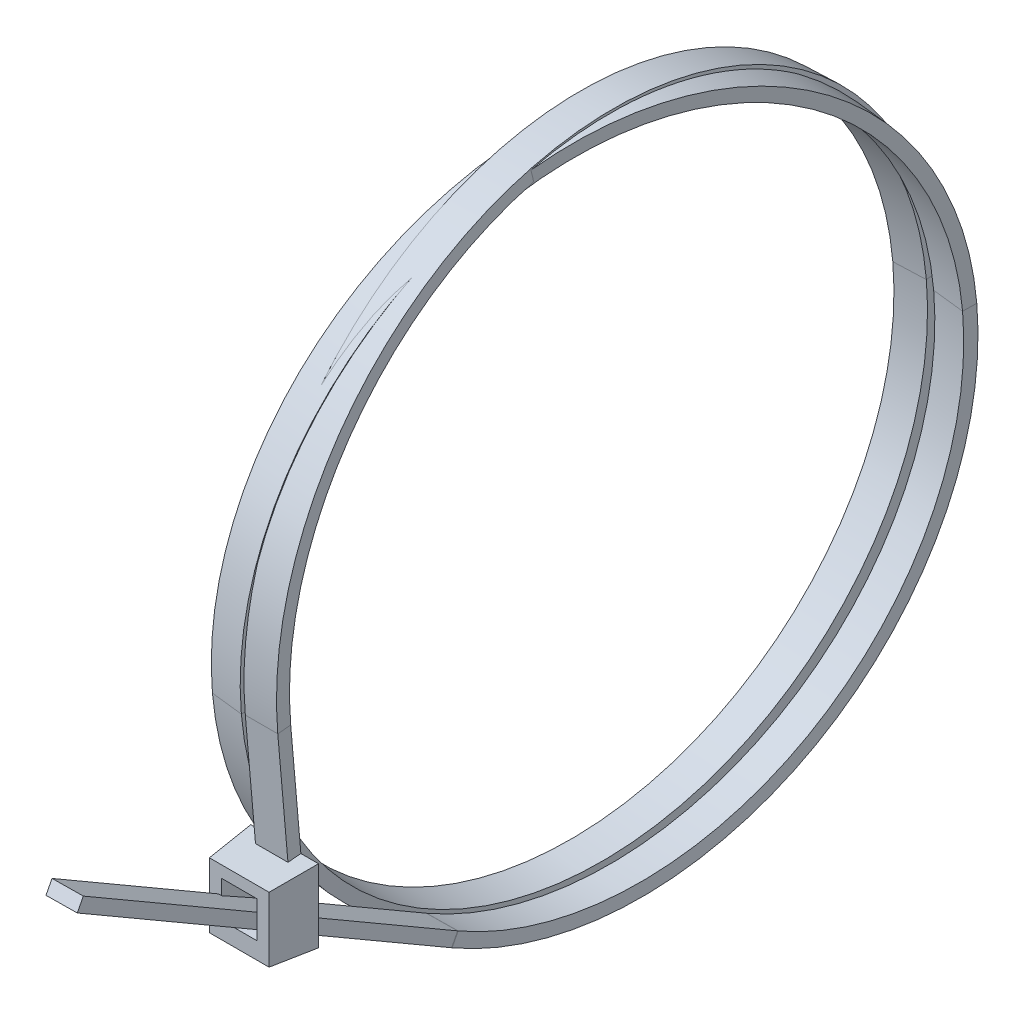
SolidWorks part; units mm, degrees
ref_plane "Plane1" through (0, 0, 0) normal (0, 0, 1) x (1, 0, 0)
ref_plane "Plane2" through (0, 0, 0) normal (0, 1, 0) x (1, 0, 0)
ref_plane "Plane3" through (0, 0, 0) normal (1, 0, 0) x (0, 0, -1)
sketch "Sketch1" plane through (0, 0, 0) normal (0, 0, 1) x (1, 0, 0)
  line L0 (-2.3, 2.5) -> (2.3, 2.5)
  line L1 (-2.3, 2.5) -> (-2.3, -2.5)
  line L2 (2.3, -2.5) -> (-2.3, -2.5)
  line L3 (2.3, -2.5) -> (2.3, 2.5)
  dimension "D1" = 2.3
  dimension "D2" = 4.6
  dimension "D3" = 5
  dimension "D4" = 2.5
extrude "Base-Extrude" add sketch "Sketch1" against normal blind 3.5 draft 5
sketch "Sketch2" plane through (0, 0, 0) normal (0, 0, 1) x (1, 0, 0)
  line L0 (-1.35, 1.6) -> (1.35, 1.6)
  line L1 (-1.35, 1.6) -> (-1.35, -1.2)
  line L2 (1.35, -1.2) -> (-1.35, -1.2)
  line L3 (1.35, -1.2) -> (1.35, 1.6)
  line L5 (2.3, -2.5) -> (-2.3, -2.5) construction
  dimension "D1" = 2.7
  dimension "D2" = 1.35
  dimension "D3" = 2.8
  dimension "D4" = 1.3
extrude "Cut-Extrude1" cut sketch "Sketch2" against normal through all
sketch "Sketch3" plane through (0, 0, 0) normal (1, 0, 0) x (0, 0, -1)
  line L0 (2.4, 2.71) -> (2.4, 6.21) construction
  line L1 (3.5, 2.8062) -> (0, 2.5) construction
  line L3 (3.5, -2.8062) -> (3.5, 2.8062) construction
  line L4 (8.1864, -1) -> (-16.6, -1) construction
  circle A1 centre (13.4, 8) radius 9
  dimension "D3" = 9
  dimension "D4" = 1
  dimension "D6" = 13.4
  dimension "D1" = 3.5
  dimension "D2" = 1.1
sketch "Sketch8" plane through (0, 2.481, 0.2171) normal (0, 0.9962, 0.0872) x (1, 0, 0)
  line L0 (-2.6062, 3.7313) -> (2.6062, 3.7313) construction
  line L1 (1.25, 3.7313) -> (-1.25, 3.7313)
  line L2 (1.25, 3.7313) -> (1.25, 2.7313)
  line L3 (1.25, 2.7313) -> (-1.25, 2.7313)
  line L4 (-1.25, 3.7313) -> (-1.25, 2.7313)
  line L5 (0, 2.7313) -> (0, 0.2179) construction
  line L6 (-2.3, 0.2179) -> (2.3, 0.2179) construction
  dimension "D1" = 2.5
  dimension "D2" = 1
extrude "Boss-Extrude1" add sketch "Sketch8" along normal blind 9
sketch "Sketch4" plane through (0, 11.4468, 1.0015) normal (0, 0.9962, 0.0872) x (1, 0, 0)
  line L0 (-2.6062, 3.7313) -> (-1.25, 3.7313) construction
  line L1 (-1.25, 3.7313) -> (1.25, 3.7313)
  line L2 (-1.25, 3.7313) -> (-1.25, 2.7313)
  line L3 (-1.25, 2.7313) -> (1.25, 2.7313)
  line L4 (1.25, 3.7313) -> (1.25, 2.7313)
  line L5 (0, 0.2179) -> (0, 2.7313) construction
  line L6 (-2.3, 0.2179) -> (2.3, 0.2179) construction
  line L7 (0, 3.7313) -> (0, 28.7313) construction
  line L8 (0, 28.7313) -> (5.3718, 28.825) construction
  dimension "D1" = 2.5
  dimension "D2" = 1
  dimension "D3" = 91
  dimension "D4" = 25
revolve "Revolve1" add sketch "Sketch4" angle 180 about L8
sketch "Sketch5" plane through (0, 11.4468, 1.0015) normal (0, -0.9962, -0.0872) x (1, 0, 0)
  line L0 (-0.8725, -53.716) -> (-0.8725, -28.716) construction
  line L1 (-0.8725, -28.716) -> (-4.5821, -28.8456) construction
  line L4 (-2.1217, -53.6724) -> (-2.1566, -54.6718)
  line L5 (-2.1566, -54.6718) -> (0.3419, -54.759)
  line L6 (0.3419, -54.759) -> (0.3768, -53.7597)
  line L7 (0.3768, -53.7597) -> (-2.1217, -53.6724)
  line L8 (-2.1217, -53.6724) -> (-2.1566, -54.6718)
  line L9 (-2.1566, -54.6718) -> (0.3419, -54.759)
  line L10 (0.3419, -54.759) -> (0.3768, -53.7597)
  line L11 (0.3768, -53.7597) -> (-2.1217, -53.6724)
  dimension "D2" = 88
  dimension "D3" = 25
  dimension "D1" = 0
revolve "Revolve2" add sketch "Sketch5" angle 180 about L1
sketch "Sketch6" plane through (0, 11.4468, 1.0015) normal (0, 0.9962, 0.0872) x (1, 0, 0)
  line L0 (-2.6164, 3.7769) -> (-2.6164, 28.7769) construction
  line L1 (-2.6164, 28.7769) -> (-6.3175, 29.1659) construction
  line L4 (-1.3732, 3.6463) -> (-3.8596, 3.9076)
  line L5 (-3.8596, 3.9076) -> (-3.9641, 2.9131)
  line L6 (-3.9641, 2.9131) -> (-1.4778, 2.6517)
  line L7 (-1.4778, 2.6517) -> (-1.3732, 3.6463)
  line L8 (-1.3732, 3.6463) -> (-3.8596, 3.9076)
  line L9 (-3.8596, 3.9076) -> (-3.9641, 2.9131)
  line L10 (-3.9641, 2.9131) -> (-1.4778, 2.6517)
  line L11 (-1.4778, 2.6517) -> (-1.3732, 3.6463)
  dimension "D2" = 25
  dimension "D3" = 96
  dimension "D1" = 0
revolve "Revolve3" add sketch "Sketch6" angle 180 about L1
sketch "Sketch7" plane through (0, 11.4468, 1.0015) normal (0, -0.9962, -0.0872) x (1, 0, 0)
  line L0 (2.5814, -53.2306) -> (2.5814, -28.2306) construction
  line L1 (2.5814, -28.2306) -> (8.0704, -27.9429) construction
  line L8 (3.8245, -53.1) -> (1.3382, -53.3613)
  line L9 (1.3382, -53.3613) -> (1.4428, -54.3558)
  line L10 (1.4428, -54.3558) -> (3.9291, -54.0945)
  line L11 (3.9291, -54.0945) -> (3.8245, -53.1)
  line L14 (3.8245, -53.1) -> (1.3382, -53.3613)
  line L15 (1.3382, -53.3613) -> (1.4428, -54.3558)
  line L16 (1.4428, -54.3558) -> (3.9291, -54.0945)
  line L17 (3.9291, -54.0945) -> (3.8245, -53.1)
  point P7 (8.0743, -18.974)
  dimension "D2" = 25
  dimension "D3" = 93
  dimension "D1" = 0
revolve "Revolve4" add sketch "Sketch7" angle 124 about L1
sketch "Sketch9" plane through (0.7402, -8.2719, -14.9006) normal (-0.0434, 0.4849, 0.8735) x (0.9986, -0.0046, 0.0521)
  line L0 (-1.4301, -0.1642) -> (-3.9267, -0.295) construction
  line L1 (-3.9267, -0.295) -> (-3.9267, -8.858) construction
  line L4 (-1.404, -0.6635) -> (1.0926, -0.5326)
  line L5 (1.0926, -0.5326) -> (1.0403, 0.466)
  line L6 (1.0403, 0.466) -> (-1.4563, 0.3352)
  line L7 (-1.4563, 0.3352) -> (-1.404, -0.6635)
  line L8 (-1.404, -0.6635) -> (1.0926, -0.5326)
  line L9 (1.0926, -0.5326) -> (1.0403, 0.466)
  line L10 (1.0403, 0.466) -> (-1.4563, 0.3352)
  line L11 (-1.4563, 0.3352) -> (-1.404, -0.6635)
  dimension "D2" = 2.5
  dimension "D1" = 0
revolve "Revolve5" add sketch "Sketch9" angle 0.5 about L1
sketch "Sketch10" plane through (0.887, -8.2554, -14.8618) normal (-0.0521, 0.4849, 0.873) x (-0.988, -0.1523, 0.0256)
  line L4 (1.5219, -0.6101) -> (1.6447, 0.3823)
  line L5 (1.6447, 0.3823) -> (-0.8364, 0.6892)
  line L7 (-0.9592, -0.3032) -> (1.5219, -0.6101)
  line L8 (1.5219, -0.6101) -> (1.6447, 0.3823)
  line L11 (-0.9592, -0.3032) -> (1.5219, -0.6101)
  line L16 (1.6447, 0.3823) -> (-0.8364, 0.6892)
  line L18 (-0.8364, 0.6892) -> (-0.9592, -0.3032)
  line L19 (-0.8364, 0.6892) -> (-0.9592, -0.3032)
  dimension "D1" = 0
extrude "Boss-Extrude3" add sketch "Sketch10" along normal blind 31.17
